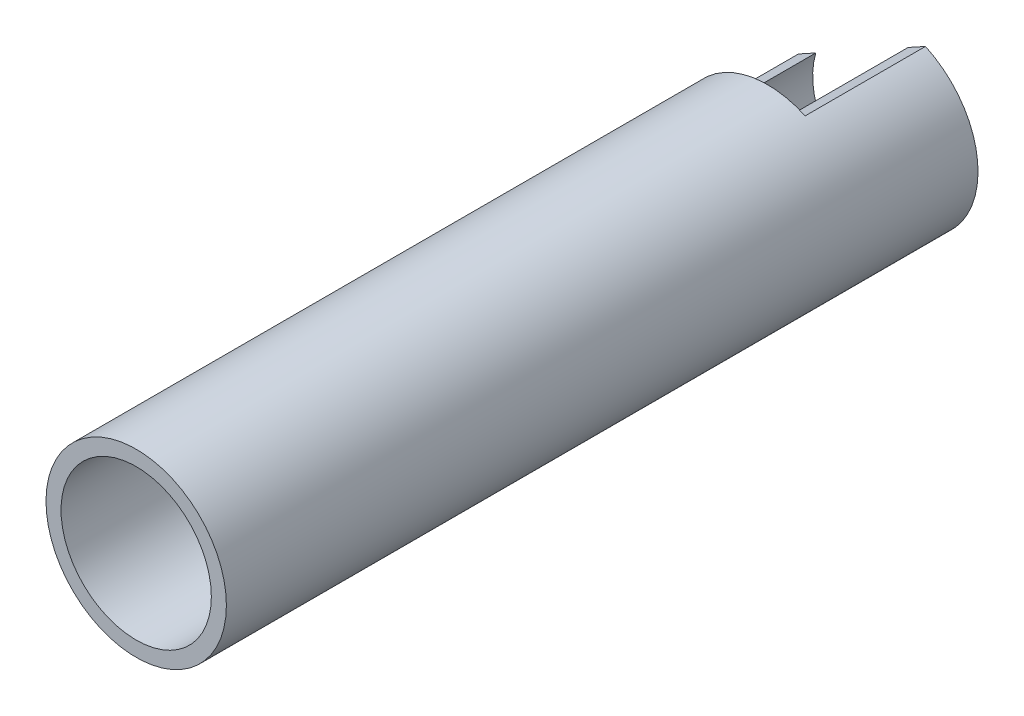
SolidWorks part; units mm, degrees
ref_plane "Front Plane" through (0, 0, 0) normal (0, 0, 1) x (1, 0, 0)
ref_plane "Top Plane" through (0, 0, 0) normal (0, 1, 0) x (1, 0, 0)
ref_plane "Right Plane" through (0, 0, 0) normal (1, 0, 0) x (0, 0, -1)
sketch "Sketch1" plane through (0, 0, 0) normal (0, 0, 1) x (1, 0, 0)
  circle A1 centre (0, 0) radius 60
  circle A2 centre (0, 0) radius 50
  circle A3 centre (0, 0) radius 50
  dimension "D1" = 3
  dimension "D2" = 10
extrude "Boss-Extrude1" add sketch "Sketch1" along normal blind 500
ref_plane "Plane1" through (-31.7062, 57.4967, 0) normal (-0.4829, 0.8757, 0) x (0.8757, 0.4829, 0)
sketch "Sketch2" plane through (-31.7062, 57.4967, 0) normal (-0.4829, 0.8757, 0) x (0.8757, 0.4829, 0)
  line L2 (-50, 0) -> (-50, -80)
  line L3 (-50, -80) -> (50, -80)
  line L4 (50, -80) -> (50, 0)
  line L7 (-50, 0) -> (50, 0)
  line L8 (315.2096, 0) -> (-284.7904, 0) construction
  line L9 (0, 0) -> (0, -438.4114) construction
  dimension "D1" = 0
  dimension "D2" = 80
  dimension "D3" = 100
extrude "Cut-Extrude1" cut sketch "Sketch2" against normal blind 30
